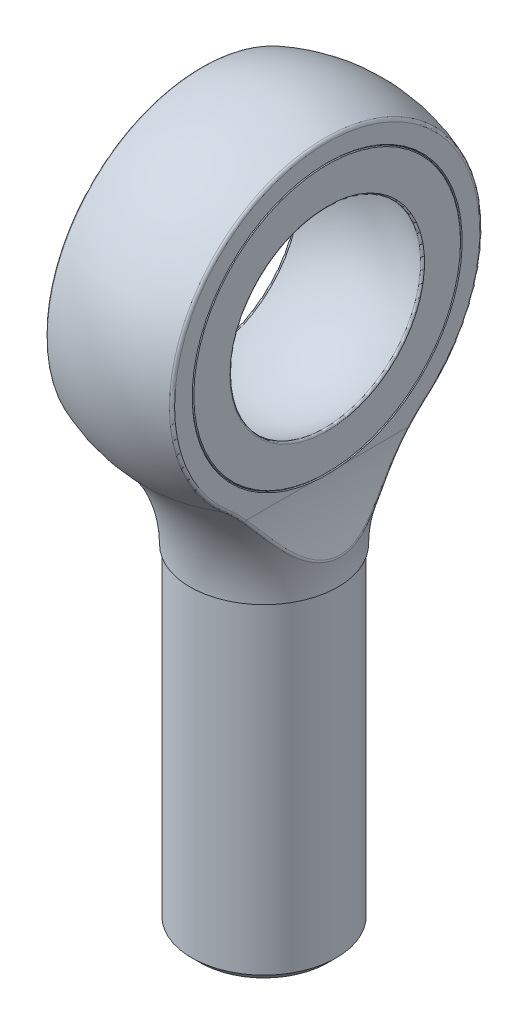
SolidWorks part; units mm, degrees
ref_plane "Front Plane" through (0, 0, 0) normal (0, 0, 1) x (1, 0, 0)
ref_plane "Top Plane" through (0, 0, 0) normal (0, 1, 0) x (1, 0, 0)
ref_plane "Right Plane" through (0, 0, 0) normal (1, 0, 0) x (0, 0, -1)
sketch "Sketch1" plane through (0, 0, 0) normal (0, 0, 1) x (1, 0, 0)
  line L0 (0, 0) -> (9.7155, 0) construction
  line L1 (0, 20.6375) -> (9.7155, 20.6375)
  line L2 (9.7155, 20.6375) -> (9.7155, 14.5103)
  line L3 (0, 20.6375) -> (0, 17.4625)
  line L4 (0, 0) -> (0, 17.4625) construction
  arc A0 (9.7155, 14.5103) -> (0, 17.4625) centre (0, 0) ccw
  dimension "Ball_Dia" = 34.925
  dimension "S" = 41.275
  dimension "H" = 19.431
revolve "Revolve1" add sketch "Sketch1" angle 360 about L0
chamfer "Chamfer1" distance 0.127 angle 45 1 edges at (9.7155, 0, 20.6375)
fillet "Fillet1" radius 0.254 1 edges at (9.7155, 0, 14.5103)
mirror "Mirror1" about plane through (0, 0, 0) normal (1, 0, 0)
sketch "Sketch2" plane through (0, 0, 0) normal (0, 0, 1) x (1, 0, 0)
  line L0 (0, 0) -> (0, 32.415) construction
  line L1 (0, 25.7175) -> (0, -85.725)
  line L2 (0, -85.725) -> (11.1125, -85.725)
  line L4 (11.3665, -34.925) -> (11.1125, -34.925)
  line L5 (11.1125, -34.925) -> (11.1125, -85.725)
  arc A0 (11.3665, -34.925) -> (18.2874, -18.082) centre (35.3217, -34.925) cw
  arc A1 (18.2874, -18.082) -> (0, 25.7175) centre (0, 0) ccw
  dimension "D" = 51.435
  dimension "D2" = 0.254
  dimension "A" = 85.725
  dimension "Thread_Dia" = 22.225
  dimension "C" = 50.8
revolve "Revolve2" add sketch "Sketch2" angle 360 about L0
sketch "Sketch3" plane through (0, 0, 0) normal (0, 0, 1) x (1, 0, 0)
  line L0 (9.7155, 55.5625) -> (9.7155, -20.6375)
  line L1 (9.7155, -20.5105) -> (9.7155, 20.5105) construction
  line L2 (-9.5885, -20.6375) -> (9.5885, -20.6375) construction
  arc A0 (9.7155, -20.6375) -> (35.1155, -46.0375) centre (35.1155, -20.6375) ccw
  dimension "D1" = 25.4
  dimension "D2" = 76.2
extrude "Cut-Extrude1" cut sketch "Sketch3" against normal through all and the other way through all
mirror "Mirror2" about plane through (0, 0, 0) normal (1, 0, 0) of "Cut-Extrude1"
sketch "Sketch4" plane through (0, 0, 0) normal (1, 0, 0) x (0, 0, -1)
  circle A0 centre (0, 0) radius 20.6375 construction
  circle A1 centre (0, 0) radius 20.6375
extrude "Cut-Extrude2" cut sketch "Sketch4" against normal through all both and the other way through all
chamfer "Chamfer2" distance 0.127 angle 45 1 edges at (9.7155, 20.6375, 0)
chamfer "Chamfer3" distance 1.27 angle 45 1 edges at (0, -85.725, -11.1125)
fillet "Fillet2" radius 0.508 8 edges at (-9.7155, -54.3043, -48.4388) (-11.7338, -30.5599, -0.8909) (9.7155, -54.3043, -48.4388) (11.7338, -30.5599, -0.8909) (-9.7155, 23.8117, 0) (9.7155, 23.8117, 0)
